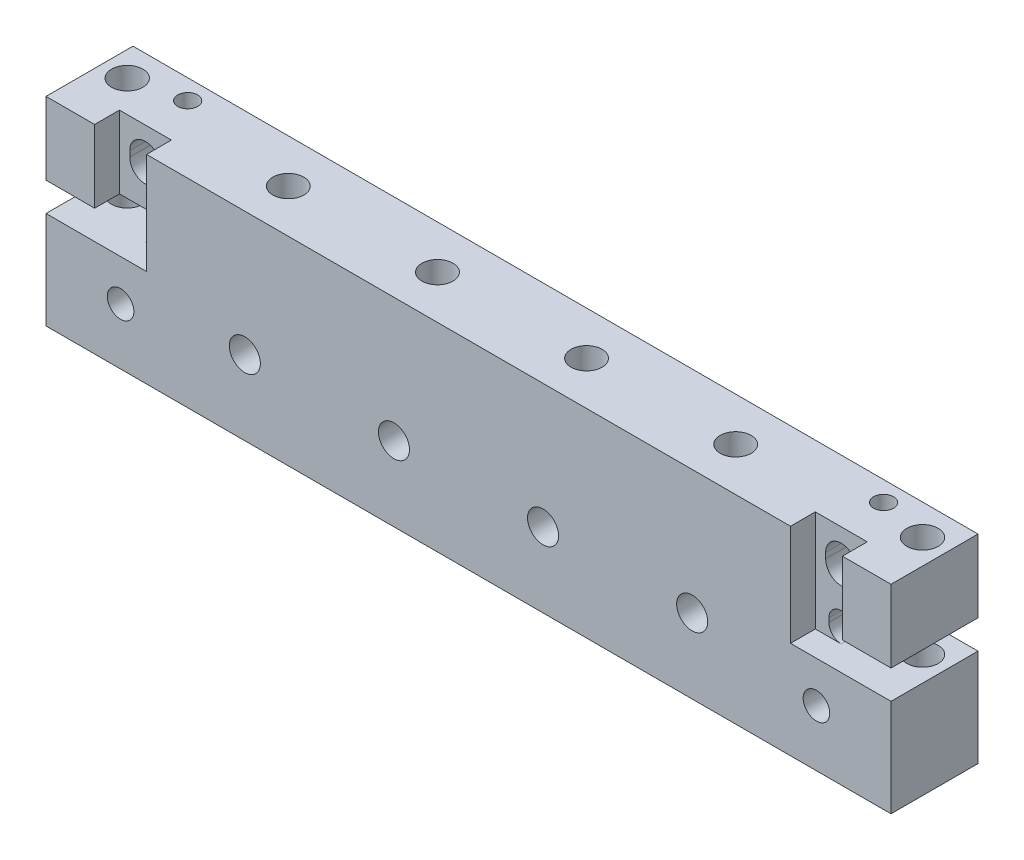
SolidWorks part; units mm, degrees
ref_plane "Front Plane" through (0, 0, 0) normal (0, 0, 1) x (1, 0, 0)
ref_plane "Top Plane" through (0, 0, 0) normal (0, 1, 0) x (1, 0, 0)
ref_plane "Right Plane" through (0, 0, 0) normal (1, 0, 0) x (0, 0, -1)
sketch "Sketch1" plane through (0, 0, 0) normal (0, 0, 1) x (1, 0, 0)
  line L1 (0, 0) -> (215.9, 0)
  line L2 (0, 0) -> (0, 50.8)
  line L3 (0, 50.8) -> (215.9, 50.8)
  line L4 (215.9, 0) -> (215.9, 50.8)
  dimension "D1" = 215.9
  dimension "D2" = 50.8
extrude "Extrude1" add sketch "Sketch1" along normal blind 22.225
ref_plane "Plane1" through (0, 31.75, 0) normal (0, -1, 0) x (1, 0, 0)
ref_plane "Plane2" through (0, 25.4, 0) normal (0, -1, 0) x (1, 0, 0)
sketch "Sketch2" plane through (0, 0, 22.225) normal (0, 0, 1) x (1, 0, 0)
  line L0 (107.95, 50.8) -> (107.95, 0) construction
  line L1 (215.9, 50.8) -> (0, 50.8) construction
  line L2 (0, 0) -> (215.9, 0) construction
  line L3 (17.2861, 28.575) -> (95.7792, 28.575) construction
  line L4 (-12.2238, 31.75) -> (12.2238, 31.75) construction
  line L5 (215.9, 0) -> (215.9, 50.8) construction
  line L6 (215.9, 32.258) -> (196.85, 32.258)
  line L7 (215.9, 32.258) -> (215.9, 24.892)
  line L8 (215.9, 24.892) -> (196.85, 24.892)
  line L9 (193.675, 29.083) -> (193.675, 28.067)
  line L10 (22.225, 29.083) -> (22.225, 28.067)
  line L11 (0, 24.892) -> (19.05, 24.892)
  line L12 (0, 32.258) -> (0, 24.892)
  line L13 (0, 32.258) -> (19.05, 32.258)
  arc A0 (22.225, 29.083) -> (19.05, 32.258) centre (19.05, 29.083) ccw
  arc A1 (19.05, 24.892) -> (22.225, 28.067) centre (19.05, 28.067) ccw
  arc A2 (193.675, 28.067) -> (196.85, 24.892) centre (196.85, 28.067) ccw
  arc A3 (193.675, 29.083) -> (196.85, 32.258) centre (196.85, 29.083) cw
  point P22 (22.225, 32.258)
  point P25 (22.225, 24.892)
  point P28 (193.675, 24.892)
  point P31 (193.675, 32.258)
  dimension "D4" = 3.175
  dimension "D5" = 3.175
  dimension "D1" = 3.175
  dimension "D2" = 7.366
  dimension "D3" = 22.225
extrude "Clearance Slot" cut sketch "Sketch2" against normal through all
hole_wizard "M8x1.25 Tapped Hole1" positions "Sketch5" profile "Sketch6" tap size "M8x1.25" standard "Ansi Metric"
sketch "Sketch5" plane through (0, 0, 22.225) normal (0, 0, 1) x (1, 0, 0)
  line L0 (107.95, 0) -> (107.95, 50.8) construction
  line L1 (0, 0) -> (215.9, 0) construction
  line L2 (215.9, 50.8) -> (0, 50.8) construction
  line L3 (-12.2238, 25.4) -> (12.2238, 25.4) construction
  point P0 (196.85, 14.4)
  point P12 (19.05, 14.4)
  dimension "D1" = 11
  dimension "D2" = 177.8
sketch "Sketch6" plane through (196.85, 14.4, 22.225) normal (1, 0, 0) x (0, -1, 0)
  line L0 (0, 0) -> (0, 22.225)
  line L1 (0, 22.225) -> (3.4, 22.225)
  line L2 (3.4, 22.225) -> (3.4, 0)
  line L5 (3.4, 0) -> (0, 0)
  line L11 (0, -6.35) -> (0, 107.95) construction
  dimension "Thru Tap Drill Dia." = 6.8
  dimension "Thru Tap Drill Depth" = 22.225
hole_wizard "3/8-16 Tapped Hole4" positions "Sketch8" profile "Sketch9" tap size "3/8-16" standard "ANSI Inch"
sketch "Sketch8" plane through (0, 0, 22.225) normal (0, 0, 1) x (1, 0, 0)
  line L0 (107.95, 0) -> (107.95, 50.8) construction
  line L1 (0, 0) -> (215.9, 0) construction
  line L2 (215.9, 50.8) -> (0, 50.8) construction
  point P0 (88.9, 19.05)
  point P11 (127, 19.05)
  point P12 (165.1, 19.05)
  point P15 (50.8, 19.05)
  dimension "D1" = 19.05
  dimension "D2" = 38.1
  dimension "D3" = 38.1
sketch "Sketch9" plane through (88.9, 19.05, 22.225) normal (1, 0, 0) x (0, -1, 0)
  line L0 (0, 0) -> (0, 26.2099)
  line L1 (0, 26.2099) -> (3.9687, 23.8252)
  line L2 (3.9687, 23.8252) -> (3.9687, 0)
  line L5 (3.9687, 0) -> (0, 0)
  line L10 (0, 26.2099) -> (-3.9688, 23.8252) construction
  line L11 (0, -6.35) -> (0, 107.95) construction
  dimension "Tap Drill Dia." = 7.9375
  dimension "Tap Drill Depth" = 23.8252
  dimension "Drill Angle" = 118
sketch "Sketch10" plane through (0, 0, 22.225) normal (0, 0, 1) x (1, 0, 0)
  line L0 (-12.2238, 31.75) -> (12.2238, 31.75) construction
  line L1 (107.95, 50.8) -> (107.95, 0) construction
  line L2 (215.9, 50.8) -> (0, 50.8) construction
  line L3 (0, 0) -> (215.9, 0) construction
  line L4 (23.05, 41.75) -> (23.05, 43.18)
  line L5 (15.05, 41.75) -> (15.05, 43.18)
  line L6 (200.85, 41.75) -> (200.85, 43.18)
  line L7 (192.85, 41.75) -> (192.85, 43.18)
  line L8 (19.05, 14.4) -> (19.05, 50.8) construction
  arc A0 (15.05, 41.75) -> (23.05, 41.75) centre (19.05, 41.75) ccw
  arc A1 (192.85, 43.18) -> (200.85, 43.18) centre (196.85, 43.18) cw
  arc A2 (23.05, 43.18) -> (15.05, 43.18) centre (19.05, 43.18) ccw
  arc A3 (200.85, 41.75) -> (192.85, 41.75) centre (196.85, 41.75) cw
  dimension "D1" = 8
  dimension "D2" = 10
  dimension "D4" = 7.62
extrude "Cut-Extrude2" cut sketch "Sketch10" against normal through all
sketch "Sketch11" plane through (0, 0, 22.225) normal (0, 0, 1) x (1, 0, 0)
  line L0 (19.05, 37.75) -> (19.05, 64.3489) construction
  line L1 (107.95, 50.8) -> (107.95, 0) construction
  line L2 (215.9, 50.8) -> (0, 50.8) construction
  line L3 (0, 0) -> (215.9, 0) construction
  line L5 (12.4206, 50.8) -> (25.6794, 50.8)
  line L6 (12.4206, 50.8) -> (12.4206, 31.242)
  line L7 (18.7706, 24.892) -> (25.6794, 24.892)
  line L8 (25.6794, 50.8) -> (25.6794, 24.892)
  line L9 (190.2206, 50.8) -> (190.2206, 24.892)
  line L10 (197.1294, 24.892) -> (190.2206, 24.892)
  line L11 (203.4794, 50.8) -> (203.4794, 31.242)
  line L12 (203.4794, 50.8) -> (190.2206, 50.8)
  line L13 (196.85, 24.892) -> (215.9, 24.892) construction
  arc A0 (15.05, 41.75) -> (23.05, 41.75) centre (19.05, 41.75) ccw construction
  arc A1 (12.4206, 31.242) -> (18.7706, 24.892) centre (18.7706, 31.242) ccw
  arc A2 (203.4794, 31.242) -> (197.1294, 24.892) centre (197.1294, 31.242) cw
  point P24 (12.4206, 24.892)
  dimension "D2" = 6.35
  dimension "D1" = 13.2588
extrude "Cut-Extrude3" cut sketch "Sketch11" against normal blind 6.35
hole_wizard "3/8-16 Tapped Hole5" positions "Sketch16" profile "Sketch17" tap size "3/8-16" standard "ANSI Inch"
sketch "Sketch16" plane through (0, 50.8, 0) normal (0, 1, 0) x (-1, 0, 0)
  line L3 (-107.95, 22.225) -> (-107.95, 0) construction
  line L5 (-215.9, 0) -> (0, 0) construction
  line L6 (-190.2206, 22.225) -> (-25.6794, 22.225) construction
  line L7 (-215.9, 11.1125) -> (0, 11.1125) construction
  line L8 (-215.9, 22.225) -> (-215.9, 0) construction
  line L9 (0, 22.225) -> (0, 0) construction
  point P0 (-127, 11.1125)
  point P16 (-88.9, 11.1125)
  point P34 (-165.1, 11.1125)
  point P36 (-50.8, 11.1125)
  dimension "D1" = 38.1
  dimension "D2" = 38.1
sketch "Sketch17" plane through (127, 50.8, 11.1125) normal (1, 0, 0) x (0, 0, 1)
  line L0 (0, 0) -> (0, 50.8)
  line L1 (0, 50.8) -> (3.9687, 50.8)
  line L2 (3.9687, 50.8) -> (3.9687, 0)
  line L5 (3.9687, 0) -> (0, 0)
  line L11 (0, -6.35) -> (0, 107.95) construction
  dimension "Thru Tap Drill Dia." = 7.9375
  dimension "Thru Tap Drill Depth" = 50.8
hole_wizard "1/4-20 Tapped Hole1" positions "Sketch21" profile "Sketch20" tap size "1/4-20" standard "Ansi Inch"
sketch "Sketch21" plane through (0, 50.8, 0) normal (0, 1, 0) x (-1, 0, 0)
  line L0 (-19.05, 15.875) -> (-19.05, 0) construction
  line L1 (-25.6794, 15.875) -> (-12.4206, 15.875) construction
  line L2 (-215.9, 0) -> (0, 0) construction
  line L3 (-107.95, 0) -> (-107.95, 52.8145) construction
  point P0 (-19.05, 5.08)
  point P15 (-196.85, 5.08)
  dimension "D1" = 5.08
sketch "Sketch20" plane through (19.05, 50.8, 5.08) normal (1, 0, 0) x (0, 0, 1)
  line L0 (0, 0) -> (0, 3.62)
  line L1 (0, 3.62) -> (2.5527, 3.62)
  line L2 (2.5527, 3.62) -> (2.5527, 0)
  line L5 (2.5527, 0) -> (0, 0)
  line L11 (0, -6.35) -> (0, 107.95) construction
  dimension "Thru Tap Drill Dia." = 5.1054
  dimension "Thru Tap Drill Depth" = 3.62
hole_wizard "O (0.316) Diameter Hole3" positions "Sketch23" profile "Sketch22" hole size "O" standard "ANSI Inch"
sketch "Sketch23" plane through (0, 50.8, 0) normal (0, 1, 0) x (-1, 0, 0)
  line L0 (0, 22.225) -> (0, 0) construction
  line L1 (-215.9, 0) -> (0, 0) construction
  line L2 (-215.9, 22.225) -> (-215.9, 0) construction
  point P1 (-6.35, 7.8232)
  point P4 (-209.55, 7.8232)
  dimension "D1" = 6.35
  dimension "D2" = 7.8232
  dimension "D3" = 7.8232
  dimension "D4" = 6.35
sketch "Sketch22" plane through (6.35, 50.8, 7.8232) normal (1, 0, 0) x (0, 0, 1)
  line L0 (0, 0) -> (0, 50.8)
  line L1 (0, 50.8) -> (4.0132, 50.8)
  line L2 (4.0132, 50.8) -> (4.0132, 0)
  line L5 (4.0132, 0) -> (0, 0)
  line L11 (0, -6.35) -> (0, 107.95) construction
  dimension "Thru Hole Dia." = 8.0264
  dimension "Thru Hole Depth" = 50.8
